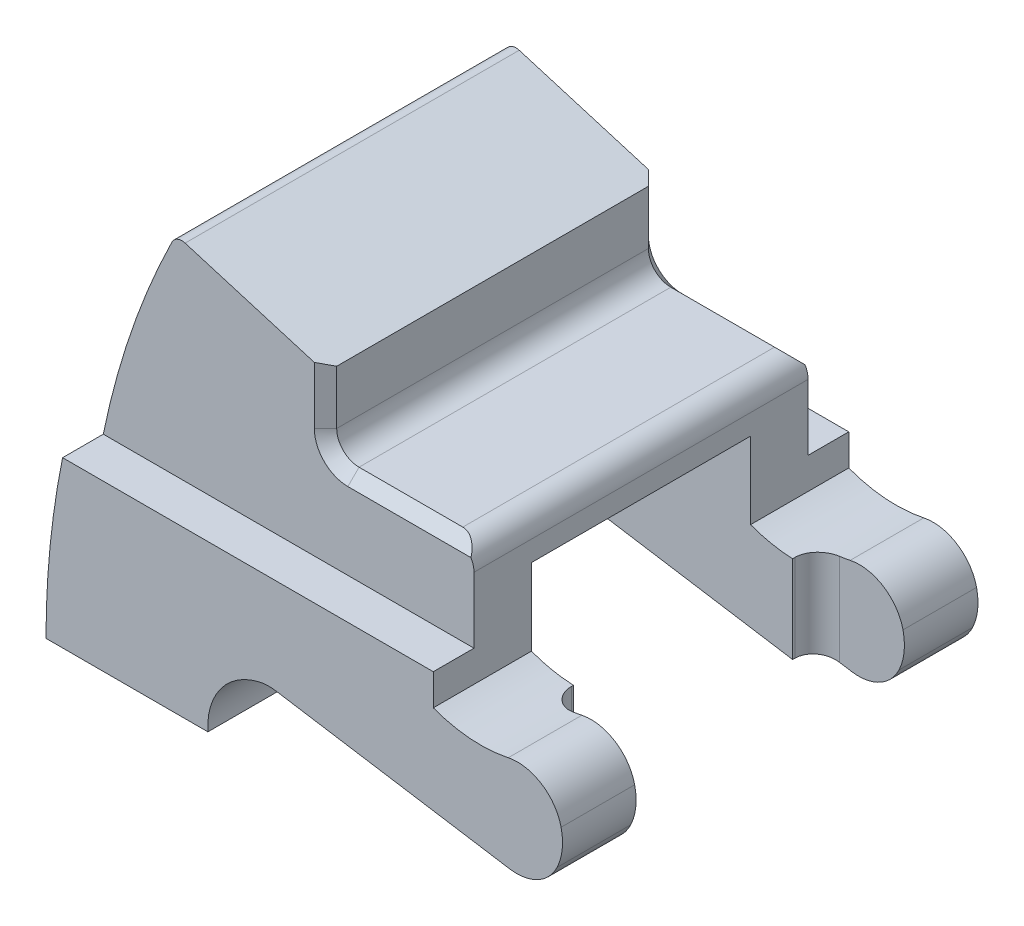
SolidWorks part; units mm, degrees
ref_plane "Front Plane" through (0, 0, 0) normal (0, 0, 1) x (1, 0, 0)
ref_plane "Top Plane" through (0, 0, 0) normal (0, 1, 0) x (1, 0, 0)
ref_plane "Right Plane" through (0, 0, 0) normal (1, 0, 0) x (0, 0, -1)
sketch "Sketch1" plane through (0, 0, 0) normal (0, 0, 1) x (1, 0, 0)
  line L1 (0, 0) -> (9.1948, 0)
  line L5 (26.3332, 1.8286) -> (13.061, 3.943)
  line L6 (13.5636, 18.6944) -> (5.08, 21.2344)
  line L7 (20.7264, 14.3637) -> (14.8336, 14.3637)
  line L8 (13.5636, 18.6944) -> (13.5636, 15.6337)
  line L9 (21.9964, 13.0937) -> (21.9964, 7.5819)
  arc A0 (29.2564, 5.3376) -> (29.0289, 3.2508) centre (26.1287, 4.6228) cw
  arc A1 (26.3332, 1.8286) -> (29.0289, 3.2508) centre (26.7328, 4.337) ccw
  arc A2 (9.1948, 0) -> (12.0658, 3.9038) centre (12.9477, 0.2476) cw
  arc A3 (13.061, 3.943) -> (12.0658, 3.9038) centre (12.6614, 1.4346) ccw
  arc A4 (5.08, 21.2344) -> (0, 0) centre (46.9199, 0) ccw
  arc A5 (14.8336, 14.3637) -> (13.5636, 15.6337) centre (14.8336, 15.6337) cw
  arc A6 (21.9964, 7.5819) -> (26.2558, 7.257) centre (24.6825, 14.7128) ccw
  arc A7 (26.2558, 7.257) -> (29.2564, 5.3376) centre (26.7802, 4.7717) cw
  arc A8 (20.7264, 14.3637) -> (21.9964, 13.0937) centre (20.7264, 13.0937) cw
  point P3 (27.3685, 7.5819)
  point P5 (9.1948, 0)
  point P6 (27.3685, 1.6637)
  point P11 (12.7, 4.0005)
  point P15 (27.3685, 1.6637)
  point P20 (12.7, 4.0005)
  point P21 (5.08, 21.2344)
  point P24 (13.5636, 18.6944)
  point P30 (13.5636, 14.3637)
  point P34 (21.9964, 14.3637)
  dimension "D5" = 1.27
  dimension "D9" = 2.54
  dimension "D10" = 2.54
  dimension "D16" = 1.27
  dimension "D17" = 7.62
  dimension "D2" = 2.54
  dimension "D3" = 9.1948
  dimension "D4" = 1.6637
  dimension "D8" = 4.0005
  dimension "D11" = 5.08
  dimension "D12" = 8.4836
  dimension "D14" = 12.7
  dimension "D15" = 8.4328
extrude "Boss-Extrude1" add sketch "Sketch1" along normal mid plane 23.5966
sketch "Sketch2" plane through (0, 0, 0) normal (1, 0, 0) x (0, 0, -1)
  line L0 (0, 0) -> (0, 21.2344) construction
  line L1 (-12.2695, 26.0552) -> (-9.4869, 26.0552)
  line L2 (-12.2695, 26.0552) -> (-12.2695, 9.3599)
  line L3 (-12.2695, 9.3599) -> (-9.4869, 9.3599)
  line L4 (-9.4869, 26.0552) -> (-9.4869, 9.3599)
  line L5 (-11.7983, 21.2344) -> (11.7983, 21.2344) construction
  line L6 (-11.7983, 0) -> (11.7983, 0) construction
  line L7 (9.4869, 26.0552) -> (9.4869, 9.3599)
  line L8 (12.2695, 9.3599) -> (9.4869, 9.3599)
  line L9 (12.2695, 26.0552) -> (12.2695, 9.3599)
  line L10 (12.2695, 26.0552) -> (9.4869, 26.0552)
  dimension "D1" = 9.4869
  dimension "D2" = 9.3599
extrude "Cut-Extrude1" cut sketch "Sketch2" along normal through all
chamfer "Chamfer5" distance 0.635 angle 45 6 edges at (17.78, 14.3637, -9.4869) (13.9356, 14.7357, -9.4869) (13.5636, 17.1641, -9.4869) (17.78, 14.3637, 9.4869) (13.9356, 14.7357, 9.4869) (13.5636, 17.1641, 9.4869)
fillet "Fillet1" radius 0.635 1 edges at (5.08, 21.2344, 0)
sketch "Sketch3" plane through (0, 0, 0) normal (1, 0, 0) x (0, 0, -1)
  line L0 (0, 0) -> (0, 21.0813) construction
  line L1 (9.4869, 21.0813) -> (-9.4869, 21.0813) construction
  line L2 (-11.7983, 0) -> (11.7983, 0) construction
  line L3 (-6.223, 0) -> (6.223, 0)
  line L4 (-6.223, 0) -> (-6.223, 11.938)
  line L5 (-6.223, 11.938) -> (6.223, 11.938)
  line L6 (6.223, 0) -> (6.223, 11.938)
  dimension "D1" = 6.223
  dimension "D2" = 12.446
  dimension "D3" = 11.938
extrude "Cut-Extrude2" cut sketch "Sketch3" along normal blind 23.5966
ref_plane "Plane1" through (0, 11.938, 0) normal (0, -1, 0) x (-1, 0, 0)
sketch "Sketch4" plane through (0, 11.938, 0) normal (0, -1, 0) x (-1, 0, 0)
  line L0 (-23.5966, -6.223) -> (-13.061, -6.223) construction
  line L1 (-18.944, -6.223) -> (-24.384, -6.223)
  line L2 (-18.944, -6.223) -> (-18.944, 6.223)
  line L3 (-18.944, 6.223) -> (-24.384, 6.223)
  line L4 (-24.384, 6.223) -> (-24.384, 6.35)
  line L5 (-21.9964, 6.223) -> (-1.5441, 6.223) construction
  line L6 (-29.337, 11.7983) -> (-29.337, -11.7983) construction
  line L7 (-29.337, -7.62) -> (-25.654, -7.62)
  line L8 (-29.337, -7.62) -> (-29.337, 7.62)
  line L9 (-29.337, 7.62) -> (-25.654, 7.62)
  line L10 (-24.384, -6.35) -> (-24.384, -6.223)
  arc A0 (-25.654, 7.62) -> (-24.384, 6.35) centre (-25.654, 6.35) cw
  arc A1 (-25.654, -7.62) -> (-24.384, -6.35) centre (-25.654, -6.35) ccw
  point P19 (-24.384, -7.62)
  dimension "D4" = 1.27
  dimension "D1" = 7.62
  dimension "D2" = 15.24
  dimension "D3" = 4.953
extrude "Cut-Extrude3" cut sketch "Sketch4" along normal blind 23.5966
ref_plane "Plane2" through (0, 0, -6.223) normal (0, 0, 1) x (1, 0, 0)
sketch "Sketch5" plane through (0, 0, -6.223) normal (0, 0, 1) x (1, 0, 0)
  line L0 (17.3736, 11.93) -> (4.9022, 14.7052)
  line L1 (4.9022, 14.7052) -> (4.268, 19.5522)
  line L2 (4.268, 19.5522) -> (1.5391, 19.5522)
  line L3 (1.5391, 19.5522) -> (1.5391, 11.93)
  line L4 (1.5391, 11.93) -> (17.3736, 11.93)
  arc A1 (5.5912, 21.0813) -> (4.8396, 20.7539) centre (5.4091, 20.473) ccw construction
  arc A2 (4.8396, 20.7539) -> (0.9431, 9.3599) centre (46.9199, 0) ccw construction
  point P0 (21.9964, 11.938)
  point P1 (4.9022, 14.7052)
  point P3 (17.3736, 11.93)
  point P4 (5.1555, 21.0552)
  dimension "D1" = 6.35
  dimension "D2" = 4.6228
  dimension "D3" = 17.0942
  dimension "D4" = 110
extrude "Cut-Extrude4" cut sketch "Sketch5" along normal up to surface (12.446 mm away)
